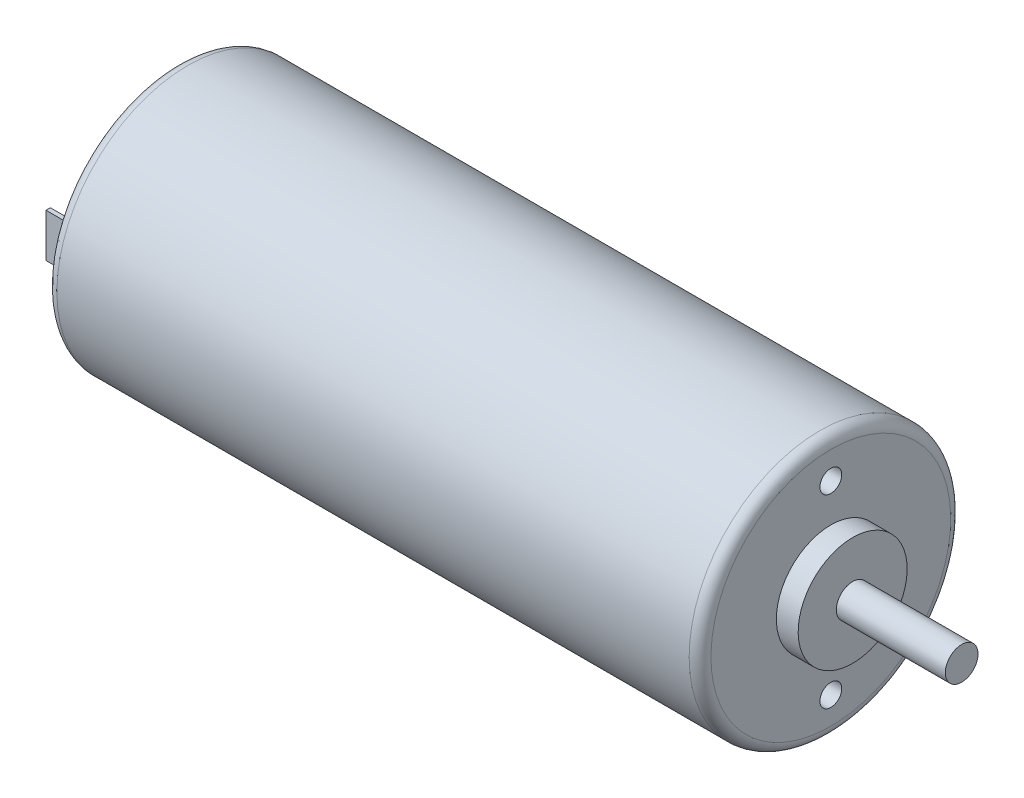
SolidWorks part; units mm, degrees
ref_plane "Plan de face" through (0, 0, 0) normal (0, 0, 1) x (1, 0, 0)
ref_plane "Plan de dessus" through (0, 0, 0) normal (0, 1, 0) x (1, 0, 0)
ref_plane "Plan de droite" through (0, 0, 0) normal (1, 0, 0) x (0, 0, -1)
sketch "Esquisse1" plane through (0, 0, 0) normal (0, 0, 1) x (1, 0, 0)
  line L0 (-16, 0) -> (-16, 2.5)
  line L1 (-15, 6) -> (15, 6)
  line L2 (15, 6) -> (15, 2.5)
  line L3 (15, 2.5) -> (16, 2.5)
  line L4 (16, 2.5) -> (16, 0.75)
  line L5 (16, 0.75) -> (21, 0.75)
  line L6 (21, 0.75) -> (21, 0)
  line L7 (21, 0) -> (-16, 0)
  line L8 (52.4688, 0) -> (-42.1365, 0) construction
  line L9 (-16, 2.5) -> (-15, 2.5)
  line L10 (-15, 2.5) -> (-15, 6)
  dimension "D1" = 30
  dimension "D2" = 15
  dimension "D3" = 12
  dimension "D4" = 1.5
  dimension "D5" = 5
  dimension "D6" = 1
  dimension "D7" = 5
  dimension "D8" = 1
  dimension "D9" = 5
revolve "Révolution1" add sketch "Esquisse1" angle 360 about L8
fillet "Congé1" radius 0.5 3 edges at (15, 6, 0) (-15, 6, 0) (-16, 2.5, 0)
sketch "Esquisse2" plane through (-15, 0, 0) normal (-1, 0, 0) x (0, 0, 1)
  line L0 (-4, 1) -> (-4, -1)
  line L1 (4, 1) -> (4, -1)
  line L2 (-4, 1) -> (-3.8, 1)
  line L3 (-3.8, 1) -> (-3.8, -1)
  line L4 (-3.8, -1) -> (-4, -1)
  line L5 (4, 1) -> (3.8, 1)
  line L6 (3.8, 1) -> (3.8, -1)
  line L7 (3.8, -1) -> (4, -1)
  dimension "D1" = 4
  dimension "D2" = 4
  dimension "D3" = 1
  dimension "D4" = 2
  dimension "D5" = 0.2
extrude "Extrusion1" add sketch "Esquisse2" along normal blind 2
sketch "Esquisse3" plane through (15, 0, 0) normal (1, 0, 0) x (0, 0, -1)
  circle A0 centre (0, -4.25) radius 0.5
  circle A1 centre (0, 4.25) radius 0.5
  dimension "D1" = 1
  dimension "D2" = 4.25
  dimension "D3" = 4.25
extrude "Enlèv. mat.-Extru.1" cut sketch "Esquisse3" against normal blind 2
